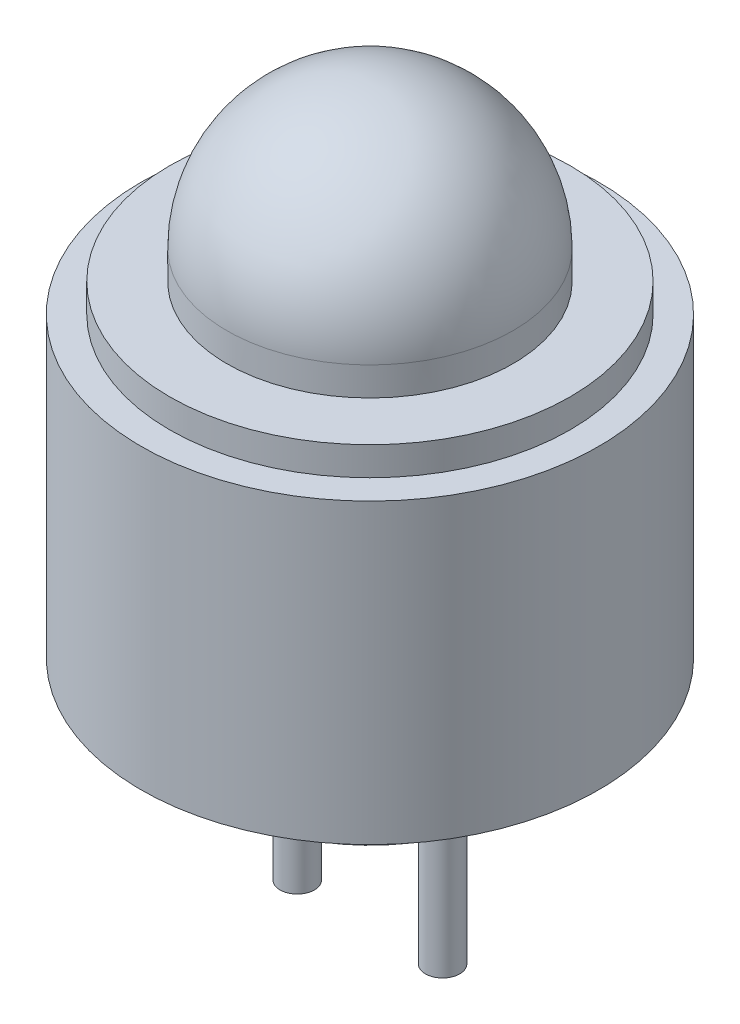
SolidWorks part; units mm, degrees
ref_plane "Front" through (0, 0, 0) normal (0, 0, 1) x (1, 0, 0)
ref_plane "Top" through (0, 0, 0) normal (0, 1, 0) x (1, 0, 0)
ref_plane "Right" through (0, 0, 0) normal (1, 0, 0) x (0, 0, -1)
sketch "Эскиз1" plane through (0, 0, 0) normal (0, 0, 1) x (1, 0, 0)
  line L0 (0, 0) -> (2.6, 0)
  line L1 (2.6, 0) -> (2.6, 1)
  line L2 (2.6, 1) -> (4, 1)
  line L3 (4, 1) -> (4, 6.2)
  line L4 (4, 6.2) -> (3.5, 6.2)
  line L5 (3.5, 6.2) -> (3.5, 6.7)
  line L6 (3.5, 6.7) -> (2.5, 6.7)
  line L7 (2.5, 6.7) -> (2.5, 7.2)
  line L8 (0, 9.7) -> (0, 0) construction
  line L9 (0, 0) -> (0, 9.7)
  arc A0 (2.5, 7.2) -> (0, 9.7) centre (0, 7.2) ccw
  dimension "D1" = 5
  dimension "D2" = 7
  dimension "D3" = 8
  dimension "D4" = 5.2
  dimension "D5" = 6.7
  dimension "D6" = 1
  dimension "D7" = 0.5
  dimension "D8" = 3
revolve "Повернуть1" add sketch "Эскиз1" angle 360 about L8
sketch "Эскиз2" plane through (0, 0, 0) normal (0, -1, 0) x (1, 0, 0)
  line L0 (-1.27, 0) -> (1.27, 0) construction
  circle A0 centre (-1.27, 0) radius 0.3
  circle A1 centre (1.27, 0) radius 0.3
  dimension "D1" = 2.54
  dimension "D2" = 0.6
extrude "Вытянуть1" add sketch "Эскиз2" along normal blind 3
